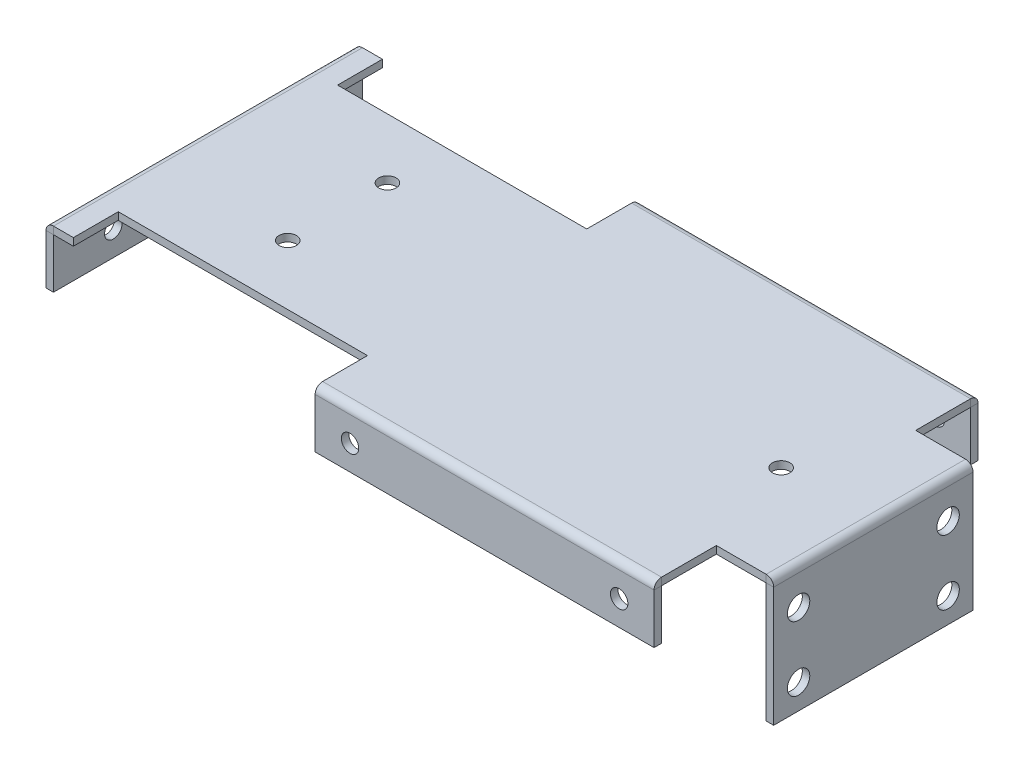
SolidWorks part; units mm, degrees
ref_plane "Front Plane" through (0, 0, 0) normal (0, 0, 1) x (1, 0, 0)
ref_plane "Top Plane" through (0, 0, 0) normal (0, 1, 0) x (1, 0, 0)
ref_plane "Right Plane" through (0, 0, 0) normal (1, 0, 0) x (0, 0, -1)
sketch "Sketch1" plane through (0, 0, 0) normal (0, 1, 0) x (1, 0, 0)
  line L0 (0, 0) -> (166, 0) construction
  line L1 (0, -31) -> (0, 31)
  line L2 (0, 31) -> (14, 31)
  line L3 (14, 31) -> (14, 22)
  line L4 (14, 22) -> (64, 22)
  line L5 (64, 22) -> (64, 41)
  line L6 (64, 41) -> (132, 41)
  line L7 (132, 41) -> (132, 20)
  line L8 (132, 20) -> (166, 20)
  line L9 (166, 20) -> (166, -20)
  line L10 (71, 36) -> (125, 36) construction
  line L11 (148, 15) -> (161, 15) construction
  line L12 (148, -15) -> (161, -15) construction
  line L13 (71, -36) -> (125, -36) construction
  line L14 (132, -20) -> (166, -20)
  line L15 (132, -41) -> (132, -20)
  line L16 (64, -41) -> (132, -41)
  line L17 (64, -22) -> (64, -41)
  line L18 (14, -22) -> (64, -22)
  line L19 (14, -31) -> (14, -22)
  line L20 (0, -31) -> (14, -31)
  line L21 (125, 36) -> (125, 0) construction
  circle A0 centre (5, 19) radius 1.75
  circle A1 centre (36, 10) radius 1.75
  circle A2 centre (71, 36) radius 1.75
  circle A3 centre (125, 36) radius 1.75
  circle A4 centre (148, 15) radius 2.25
  circle A5 centre (161, 15) radius 2.25
  circle A6 centre (161, -15) radius 2.25
  circle A7 centre (148, -15) radius 2.25
  circle A8 centre (125, -36) radius 1.75
  circle A9 centre (71, -36) radius 1.75
  circle A10 centre (36, -10) radius 1.75
  circle A11 centre (5, -19) radius 1.75
  circle A12 centre (125, 0) radius 1.75
  dimension "D9" = 3.5
  dimension "D10" = 4.5
  dimension "D11" = 5
  dimension "D12" = 12
  dimension "D13" = 10
  dimension "D15" = 7
  dimension "D17" = 7
  dimension "D18" = 15
  dimension "D19" = 18
  dimension "D20" = 13
  dimension "D21" = 3.5
  dimension "D1" = 14
  dimension "D2" = 34
  dimension "D3" = 68
  dimension "D4" = 50
  dimension "D5" = 20
  dimension "D6" = 41
  dimension "D7" = 22
  dimension "D8" = 31
  dimension "D14" = 22
  dimension "D16" = 5
sheet metal parameters "Sheet-Metal1" thickness 1.5 parameters "D1"=1
base flange "Base-Flange1" sketch "Sketch1" thickness 1.5 reverse thickness direction yes parameters "D1"=1
sketch "Sketch3" plane through (0, 1.5, 0) normal (0, 1, 0) x (1, 0, 0)
  line L0 (64, 31) -> (132, 31)
  line L1 (64, 41) -> (64, 22) construction
  line L2 (132, 20) -> (132, 41) construction
  line L3 (64, -31) -> (132, -31)
  line L4 (64, -22) -> (64, -41) construction
  line L5 (132, -41) -> (132, -20) construction
  line L6 (132, 41) -> (64, 41) construction
  line L7 (64, -41) -> (132, -41) construction
  line L8 (10, 31) -> (10, -31)
  line L9 (14, 31) -> (0, 31) construction
  line L10 (0, -31) -> (14, -31) construction
  line L11 (0, 31) -> (0, -31) construction
  line L12 (142, 20) -> (142, -20)
  line L13 (166, 20) -> (132, 20) construction
  line L14 (132, -20) -> (166, -20) construction
  line L15 (166, -20) -> (166, 20) construction
  dimension "D1" = 10
  dimension "D2" = 10
  dimension "D3" = 10
  dimension "D4" = 24
sketched bend "Sketched Bend1" parameters "D1"=0
bend "SketchBend1" bend radius 0 bend angle 90 parameters "D5"=1
bend "SketchBend2" bend radius 0 bend angle 90 parameters "D5"=2
bend "SketchBend3" bend radius 0 bend angle 90 parameters "D5"=5
bend "SketchBend4" bend radius 0 bend angle 90 parameters "D5"=6
flat pattern "Flat-Pattern1"
sketch "Bend-Lines1" plane through (0, 0, 0) normal (0, 1, 0) x (-1, 0, 0)
bend of the flat pattern "Flatten-<SketchBend1>1"
bend of the flat pattern "Flatten-<SketchBend2>1"
bend of the flat pattern "Flatten-<SketchBend3>1"
bend of the flat pattern "Flatten-<SketchBend4>1"
